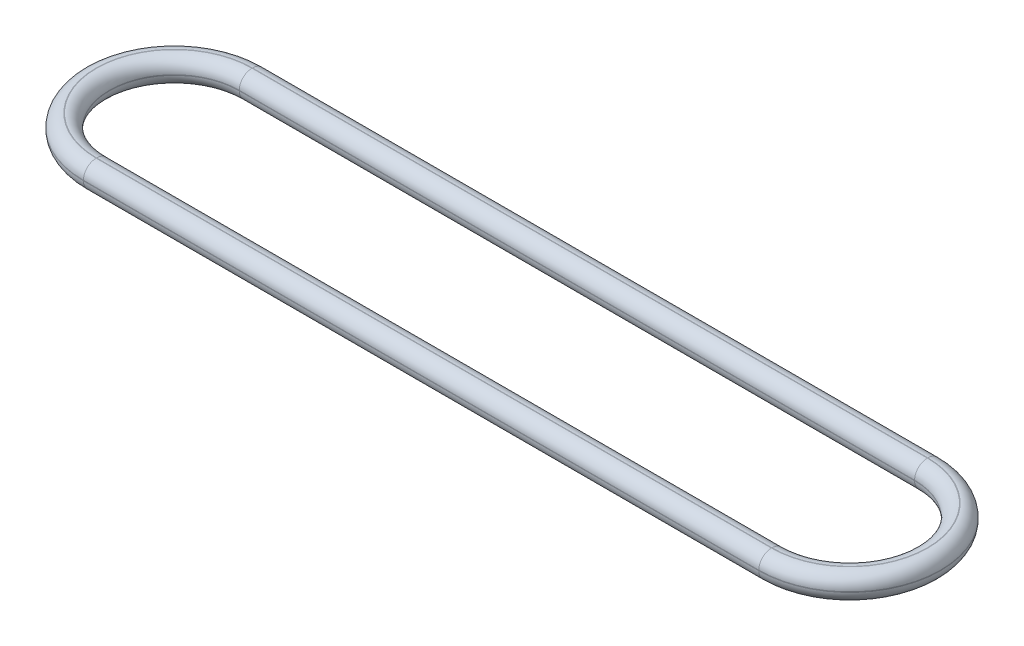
SolidWorks part; units mm, degrees
ref_plane "Front Plane" through (0, 0, 0) normal (0, 0, 1) x (1, 0, 0)
ref_plane "Top Plane" through (0, 0, 0) normal (0, 1, 0) x (1, 0, 0)
ref_plane "Right Plane" through (0, 0, 0) normal (1, 0, 0) x (0, 0, -1)
sketch "Sketch1" plane through (0, 0, 0) normal (0, 1, 0) x (1, 0, 0)
  line L0 (0, 2.5) -> (26, 2.5)
  line L1 (0, -0.55) -> (0, 0.55) construction
  line L2 (26, -2.5) -> (0, -2.5)
  line L3 (-0.55, 0) -> (0.55, 0) construction
  line L4 (0, 3.5) -> (26, 3.5)
  line L5 (26, -3.5) -> (0, -3.5)
  arc A0 (26, 2.5) -> (26, -2.5) centre (26, 0) cw
  arc A1 (0, 2.5) -> (0, -2.5) centre (0, 0) ccw
  arc A2 (26, 3.5) -> (26, -3.5) centre (26, 0) cw
  arc A3 (0, 3.5) -> (0, -3.5) centre (0, 0) ccw
  dimension "D1" = 5
  dimension "D2" = 26
  dimension "D3" = 1
extrude "Boss-Extrude1" add sketch "Sketch1" along normal blind 1
fillet "Fillet1" radius 0.49 16 edges at (-2.5, 0, 0) (13, 0, -2.5) (28.5, 0, 0) (13, 0, 2.5) (28.5, 1, 0) (13, 1, -2.5) (-2.5, 1, 0) (13, 1, 2.5) (13, 1, -3.5) (29.5, 1, 0) (13, 1, 3.5) (-3.5, 1, 0) (13, 0, 3.5) (-3.5, 0, 0) (13, 0, -3.5) (29.5, 0, 0)
